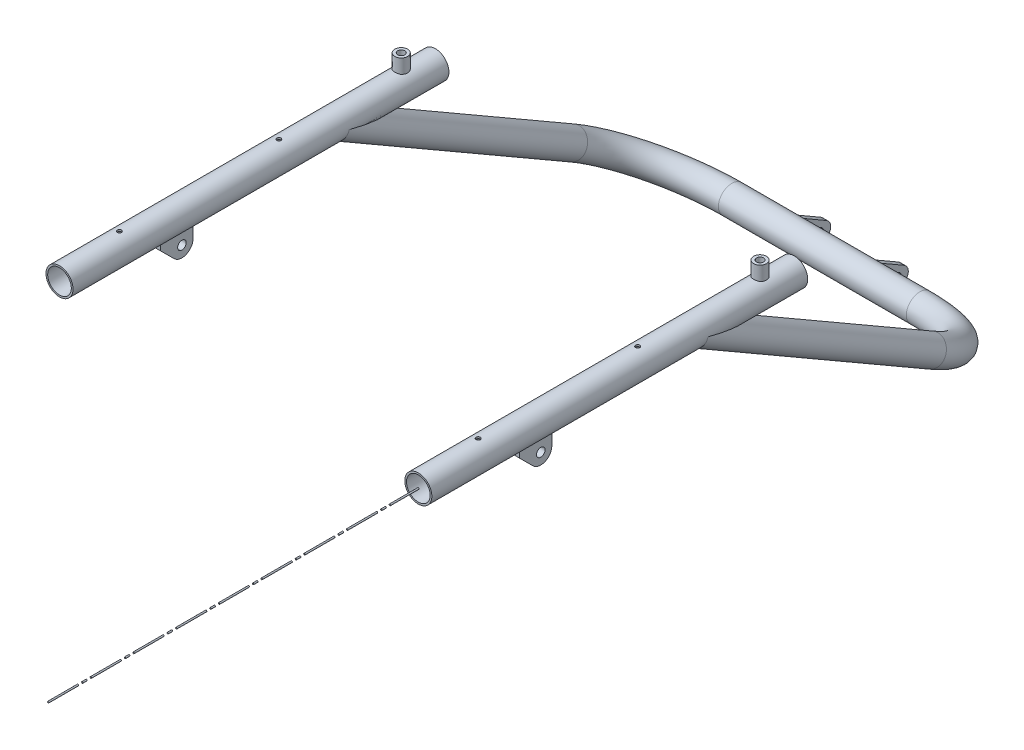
SolidWorks part; units mm, degrees
ref_plane "Plan de face" through (0, 0, 0) normal (0, 0, 1) x (1, 0, 0)
ref_plane "Plan de dessus" through (0, 0, 0) normal (0, 1, 0) x (1, 0, 0)
ref_plane "Plan de droite" through (0, 0, 0) normal (1, 0, 0) x (0, 0, -1)
imported_body "Importée3"
sketch "Esquisse1" plane through (0, 0, 0) normal (0, 0, 1) x (1, 0, 0)
  circle A0 centre (126, 0) radius 0.5
  dimension "D1" = 1
extrude "Boss.-Extru.1" add sketch "Esquisse1" along normal blind 260 separate body
ref_plane "Plan1" through (0, -0.5, 0) normal (0, -1, 0) x (-1, 0, 0)
sketch "Esquisse2" plane through (0, -0.5, 0) normal (0, -1, 0) x (-1, 0, 0)
  line L0 (-135.5, 0) -> (-116.5, 0) construction
  line L1 (-127.4583, -20) -> (-124.6192, -20)
  line L2 (-127.4583, -20) -> (-127.4583, -23)
  line L3 (-127.4583, -23) -> (-124.6192, -23)
  line L4 (-124.6192, -20) -> (-124.6192, -23)
  line L5 (-127.4583, -26) -> (-124.6192, -26)
  line L6 (-127.4583, -26) -> (-127.4583, -29)
  line L7 (-127.4583, -29) -> (-124.6192, -29)
  line L8 (-124.6192, -26) -> (-124.6192, -29)
  line L9 (-127.4583, -50) -> (-124.6192, -50)
  line L10 (-127.4583, -50) -> (-127.4583, -53)
  line L11 (-127.4583, -53) -> (-124.6192, -53)
  line L12 (-124.6192, -50) -> (-124.6192, -53)
  line L13 (-127.4583, -56) -> (-124.6192, -56)
  line L14 (-127.4583, -56) -> (-127.4583, -59)
  line L15 (-127.4583, -59) -> (-124.6192, -59)
  line L16 (-124.6192, -56) -> (-124.6192, -59)
  line L17 (-127.4583, -80) -> (-124.6192, -80)
  line L18 (-127.4583, -80) -> (-127.4583, -83)
  line L19 (-127.4583, -83) -> (-124.6192, -83)
  line L20 (-124.6192, -80) -> (-124.6192, -83)
  line L21 (-127.4583, -86) -> (-124.6192, -86)
  line L22 (-127.4583, -86) -> (-127.4583, -89)
  line L23 (-127.4583, -89) -> (-124.6192, -89)
  line L24 (-124.6192, -86) -> (-124.6192, -89)
  line L25 (-127.4583, -110) -> (-124.6192, -110)
  line L26 (-127.4583, -110) -> (-127.4583, -113)
  line L27 (-127.4583, -113) -> (-124.6192, -113)
  line L28 (-124.6192, -110) -> (-124.6192, -113)
  line L29 (-127.4583, -116) -> (-124.6192, -116)
  line L30 (-127.4583, -116) -> (-127.4583, -119)
  line L31 (-127.4583, -119) -> (-124.6192, -119)
  line L32 (-124.6192, -116) -> (-124.6192, -119)
  line L33 (-127.4583, -140) -> (-124.6192, -140)
  line L34 (-127.4583, -140) -> (-127.4583, -143)
  line L35 (-127.4583, -143) -> (-124.6192, -143)
  line L36 (-124.6192, -140) -> (-124.6192, -143)
  line L37 (-127.4583, -146) -> (-124.6192, -146)
  line L38 (-127.4583, -146) -> (-127.4583, -149)
  line L39 (-127.4583, -149) -> (-124.6192, -149)
  line L40 (-124.6192, -146) -> (-124.6192, -149)
  line L41 (-127.4583, -170) -> (-124.6192, -170)
  line L42 (-127.4583, -170) -> (-127.4583, -173)
  line L43 (-127.4583, -173) -> (-124.6192, -173)
  line L44 (-124.6192, -170) -> (-124.6192, -173)
  line L45 (-127.4583, -176) -> (-124.6192, -176)
  line L46 (-127.4583, -176) -> (-127.4583, -179)
  line L47 (-127.4583, -179) -> (-124.6192, -179)
  line L48 (-124.6192, -176) -> (-124.6192, -179)
  line L49 (-127.4583, -200) -> (-124.6192, -200)
  line L50 (-127.4583, -200) -> (-127.4583, -203)
  line L51 (-127.4583, -203) -> (-124.6192, -203)
  line L52 (-124.6192, -200) -> (-124.6192, -203)
  line L53 (-127.4583, -206) -> (-124.6192, -206)
  line L54 (-127.4583, -206) -> (-127.4583, -209)
  line L55 (-127.4583, -209) -> (-124.6192, -209)
  line L56 (-124.6192, -206) -> (-124.6192, -209)
  line L57 (-127.4583, -230) -> (-124.6192, -230)
  line L58 (-127.4583, -230) -> (-127.4583, -233)
  line L59 (-127.4583, -233) -> (-124.6192, -233)
  line L60 (-124.6192, -230) -> (-124.6192, -233)
  line L61 (-127.4583, -236) -> (-124.6192, -236)
  line L62 (-127.4583, -236) -> (-127.4583, -239)
  line L63 (-127.4583, -239) -> (-124.6192, -239)
  line L64 (-124.6192, -236) -> (-124.6192, -239)
  line L65 (-127.4583, -260) -> (-124.6192, -260)
  line L66 (-127.4583, -260) -> (-127.4583, -263)
  line L67 (-127.4583, -263) -> (-124.6192, -263)
  line L68 (-124.6192, -260) -> (-124.6192, -263)
  line L69 (-127.4583, -266) -> (-124.6192, -266)
  line L70 (-127.4583, -266) -> (-127.4583, -269)
  line L71 (-127.4583, -269) -> (-124.6192, -269)
  line L72 (-124.6192, -266) -> (-124.6192, -269)
  line L73 (-127.4583, -290) -> (-124.6192, -290)
  line L74 (-127.4583, -290) -> (-127.4583, -293)
  line L75 (-127.4583, -293) -> (-124.6192, -293)
  line L76 (-124.6192, -290) -> (-124.6192, -293)
  line L77 (-127.4583, -296) -> (-124.6192, -296)
  line L78 (-127.4583, -296) -> (-127.4583, -299)
  line L79 (-127.4583, -299) -> (-124.6192, -299)
  line L80 (-124.6192, -296) -> (-124.6192, -299)
  line L81 (-127.4583, -320) -> (-124.6192, -320)
  line L82 (-127.4583, -320) -> (-127.4583, -323)
  line L83 (-127.4583, -323) -> (-124.6192, -323)
  line L84 (-124.6192, -320) -> (-124.6192, -323)
  line L85 (-127.4583, -326) -> (-124.6192, -326)
  line L86 (-127.4583, -326) -> (-127.4583, -329)
  line L87 (-127.4583, -329) -> (-124.6192, -329)
  line L88 (-124.6192, -326) -> (-124.6192, -329)
  line L89 (-127.4583, -350) -> (-124.6192, -350)
  line L90 (-127.4583, -350) -> (-127.4583, -353)
  line L91 (-127.4583, -353) -> (-124.6192, -353)
  line L92 (-124.6192, -350) -> (-124.6192, -353)
  line L93 (-127.4583, -356) -> (-124.6192, -356)
  line L94 (-127.4583, -356) -> (-127.4583, -359)
  line L95 (-127.4583, -359) -> (-124.6192, -359)
  line L96 (-124.6192, -356) -> (-124.6192, -359)
  dimension "D1" = 3
  dimension "D2" = 3
  dimension "D3" = 20
  dimension "D4" = 3
  dimension "D5" = 12
extrude "Enlèv. mat.-Extru.2" cut sketch "Esquisse2" against normal blind 5
